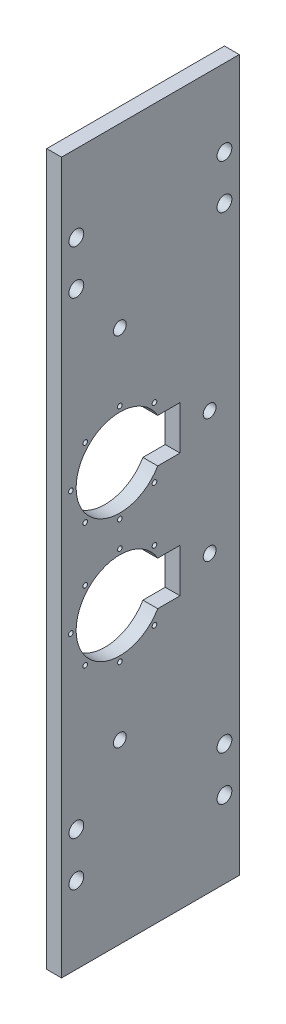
SolidWorks part; units mm, degrees
ref_plane "Front Plane" through (0, 0, 0) normal (1, 0, 0) x (0, 1, 0)
ref_plane "Top Plane" through (0, 0, 0) normal (0, 0, 1) x (0, 1, 0)
ref_plane "Right Plane" through (0, 0, 0) normal (0, 1, 0) x (-1, 0, 0)
sketch "Sketch1" plane through (0, 0, 0) normal (1, 0, 0) x (0, 1, 0)
  line L0 (0, 76.2) -> (0, -76.2) construction
  line L1 (-304.8, 76.2) -> (304.8, 76.2)
  line L2 (-304.8, 76.2) -> (-304.8, -76.2)
  line L3 (-304.8, -76.2) -> (304.8, -76.2)
  line L4 (304.8, 76.2) -> (304.8, -76.2)
  line L5 (-304.8, 76.2) -> (304.8, -76.2) construction
  line L6 (-304.8, -76.2) -> (304.8, 76.2) construction
  line L7 (53, 26.2) -> (53, -11.3) construction
  line L8 (53, 26.2) -> (71.75, -6.276) construction
  line L9 (34.25, -6.276) -> (34.25, -25.4)
  line L10 (34.25, -25.4) -> (71.75, -25.4)
  line L11 (71.75, -25.4) -> (71.75, -6.276)
  line L12 (-304.8, 0) -> (304.8, 0) construction
  line L13 (-34.25, -25.4) -> (-71.75, -25.4)
  line L14 (-34.25, -6.276) -> (-34.25, -25.4)
  line L15 (-71.75, -25.4) -> (-71.75, -6.276)
  arc A0 (71.75, -6.276) -> (34.25, -6.276) centre (53, 26.2) ccw
  circle A1 centre (53, 26.2) radius 42 construction
  circle A2 centre (53, 68.2) radius 2
  circle A3 centre (82.6985, 55.8985) radius 2
  circle A4 centre (95, 26.2) radius 2
  circle A5 centre (82.6985, -3.4985) radius 2
  circle A6 centre (53, -15.8) radius 2
  circle A7 centre (23.3015, -3.4985) radius 2
  circle A8 centre (11, 26.2) radius 2
  circle A9 centre (23.3015, 55.8985) radius 2
  circle A10 centre (238.76, 63.5) radius 6.35
  circle A11 centre (200.66, 63.5) radius 6.35
  circle A12 centre (200.66, -63.5) radius 6.35
  circle A13 centre (238.76, -63.5) radius 6.35
  circle A14 centre (-200.66, 63.5) radius 6.35
  circle A15 centre (-238.76, 63.5) radius 6.35
  circle A16 centre (-238.76, -63.5) radius 6.35
  circle A17 centre (-200.66, -63.5) radius 6.35
  circle A18 centre (-82.6985, -3.4985) radius 2
  circle A19 centre (-95, 26.2) radius 2
  circle A20 centre (-82.6985, 55.8985) radius 2
  circle A21 centre (-53, 68.2) radius 2
  circle A22 centre (-23.3015, 55.8985) radius 2
  circle A23 centre (-11, 26.2) radius 2
  circle A24 centre (-23.3015, -3.4985) radius 2
  arc A25 (-71.75, -6.276) -> (-34.25, -6.276) centre (-53, 26.2) cw
  point P0 (0, 0)
  point P8 (53, 26.2)
  point P18 (53, -50.8)
  point P19 (153, 26.2)
  point P71 (-153, 26.2)
  point P72 (-53, -50.8)
  dimension "D9" = 84
  dimension "D10" = 4
  dimension "D14" = 12.7
  dimension "D17" = 12.7
  dimension "D1" = 152.4
  dimension "D2" = 609.6
  dimension "D3" = 50
  dimension "D4" = 53
  dimension "D5" = 37.5
  dimension "D6" = 30
  dimension "D7" = 60
  dimension "D8" = 50.8
  dimension "D12" = 25.4
  dimension "D13" = 100
  dimension "D15" = 12.7
  dimension "D16" = 66.04
  dimension "D18" = 12.7
  dimension "D19" = 38.1
  dimension "D22" = 53
  dimension "D23" = 50
  dimension "D11" = 8
extrude "Boss-Extrude1" add sketch "Sketch1" along normal mid plane 12.7
hole_wizard "M12x1.0 Tapped Hole1" positions "Sketch2" profile "Sketch3" tap size "M12x1.0" standard "ISO"
sketch "Sketch2" plane through (6.35, 0, 0) normal (1, 0, 0) x (0, 0, -1)
  point P0 (50.8, 53)
  point P3 (-26.2, 153)
  point P6 (50.8, -53)
  point P9 (-26.2, -153)
sketch "Sketch3" plane through (6.35, 53, -50.8) normal (0, 1, 0) x (0, 0, -1)
  line L0 (0, 0) -> (0, 12.7)
  line L1 (0, 12.7) -> (5.5, 12.7)
  line L2 (5.5, 12.7) -> (5.5, 0)
  line L5 (5.5, 0) -> (0, 0)
  line L11 (0, -6.35) -> (0, 107.95) construction
  dimension "Thru Tap Drill Dia." = 11
  dimension "Thru Tap Drill Depth" = 12.7
